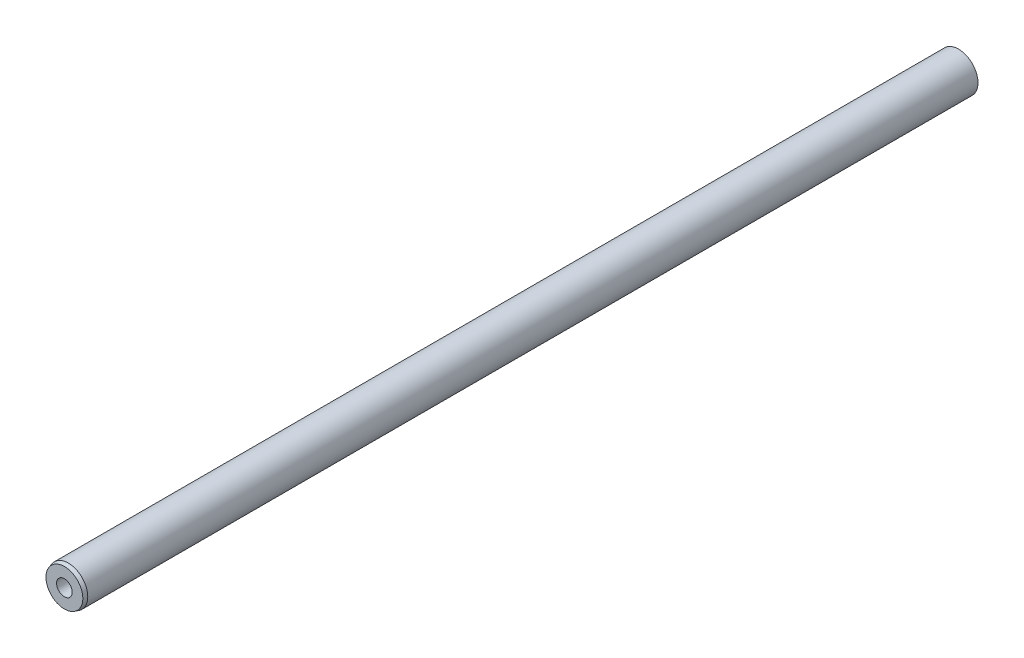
SolidWorks part; units mm, degrees
ref_plane "Front" through (0, 0, 0) normal (0, 0, 1) x (1, 0, 0)
ref_plane "Top" through (0, 0, 0) normal (0, 1, 0) x (1, 0, 0)
ref_plane "Right" through (0, 0, 0) normal (1, 0, 0) x (0, 0, -1)
sketch "Sketch1" plane through (0, 0, 0) normal (0, 0, 1) x (1, 0, 0)
  circle A0 centre (0, 0) radius 6.35
  dimension "D1" = 12.7
extrude "Base-Extrude" add sketch "Sketch1" along normal blind 291.4904
chamfer "Chamfer1" distance 1.27 angle 15 1 edges at (6.35, 0, 291.4904)
hole_wizard "1/4-20 Tapped Hole1" positions "Sketch6" profile "Sketch5"
sketch "Sketch6" plane through (0, 0, 291.4904) normal (0, 0, 1) x (1, 0, 0)
  point P0 (0, 0)
sketch "Sketch5" plane through (0, 0, 291.4904) normal (1, 0, 0) x (0, -1, 0)
  line L0 (0, 0) -> (0, 14.2338)
  line L1 (0, 14.2338) -> (2.5527, 12.7)
  line L2 (2.5527, 12.7) -> (2.5527, 0.0025)
  line L3 (2.5527, 0.0025) -> (2.5527, 0)
  line L5 (2.5527, 0) -> (0, 0)
  line L6 (-2.5527, 0.0025) -> (-2.5527, 0) construction
  line L10 (0, 14.2338) -> (-2.5527, 12.7) construction
  line L11 (0, -6.35) -> (0, 107.95) construction
